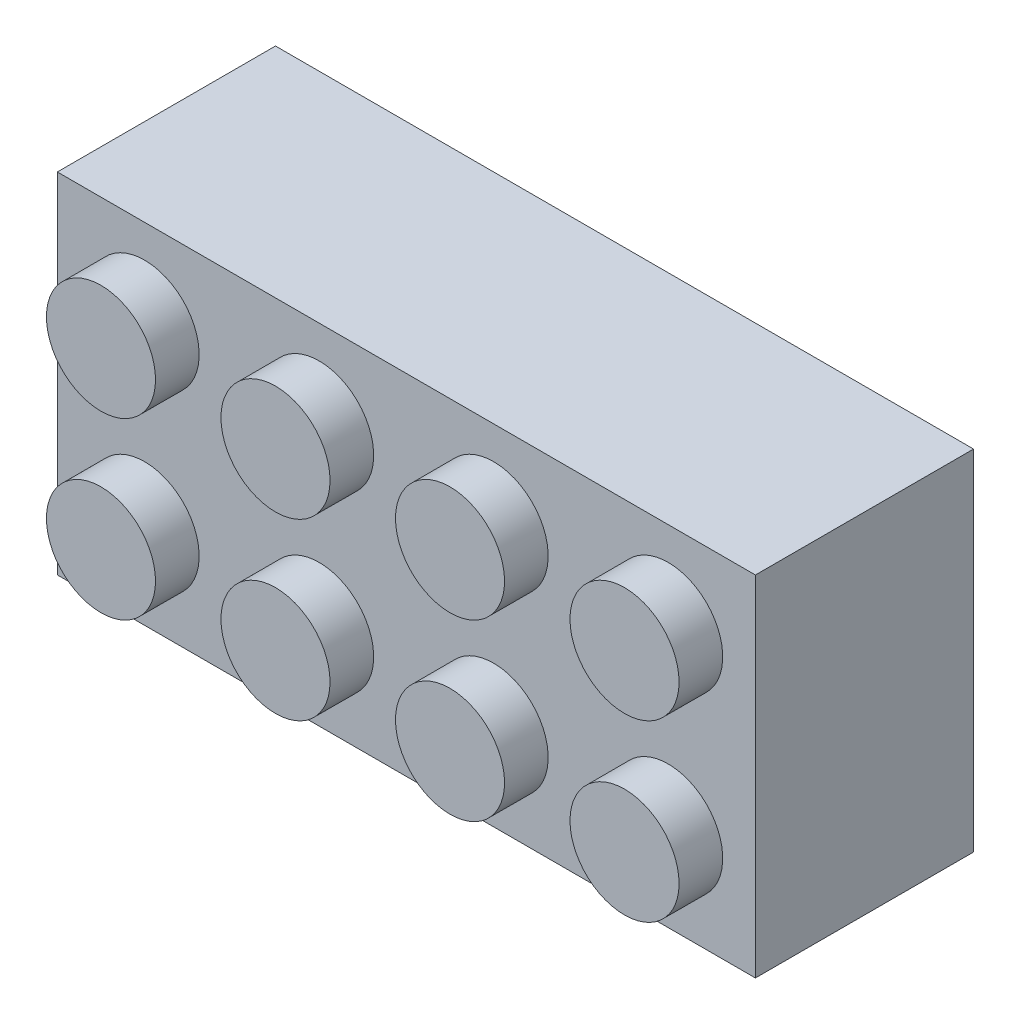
SolidWorks part; units mm, degrees
ref_plane "Plan de face" through (0, 0, 0) normal (0, 0, 1) x (1, 0, 0)
ref_plane "Plan de dessus" through (0, 0, 0) normal (0, 1, 0) x (1, 0, 0)
ref_plane "Plan de droite" through (0, 0, 0) normal (1, 0, 0) x (0, 0, -1)
sketch "Esquisse1" plane through (0, 0, 0) normal (0, 0, 1) x (1, 0, 0)
  line L1 (0, 0) -> (32, 0)
  line L2 (0, 0) -> (0, 16)
  line L3 (0, 16) -> (32, 16)
  line L4 (32, 0) -> (32, 16)
  dimension "D1" = 16
  dimension "D2" = 32
extrude "Boss.-Extru.1" add sketch "Esquisse1" along normal blind 10
sketch "Esquisse2" plane through (0, 0, 10) normal (0, 0, 1) x (1, 0, 0)
  line L0 (0, 16) -> (0, 0) construction
  line L2 (32, 16) -> (0, 16) construction
  circle A0 centre (4, 12) radius 2.5
  point P6 (6.2959, 16)
  dimension "D1" = 5
  dimension "D2" = 4
  dimension "D3" = 4
extrude "Boss.-Extru.2" add sketch "Esquisse2" along normal blind 2
pattern_linear "Répétition linéaire1" count 4 spacing 8 along (1, 0, 0) count 2 spacing 8 along (0, -1, 0) of "Boss.-Extru.2"
shell "Coque1" thickness 1
sketch "Esquisse3" plane through (0, 0, 9) normal (0, 0, -1) x (-1, 0, 0)
  line L0 (0, 16) -> (0, 0) construction
  line L1 (-32, 16) -> (0, 16) construction
  circle A0 centre (-8, 8) radius 3
  circle A1 centre (-8, 8) radius 2.5
  dimension "D1" = 6
  dimension "D2" = 5
  dimension "D3" = 8
  dimension "D4" = 8
extrude "Boss.-Extru.3" add sketch "Esquisse3" along normal blind 9
pattern_linear "Répétition linéaire2" count 3 spacing 8 along (1, 0, 0) of "Boss.-Extru.3"
